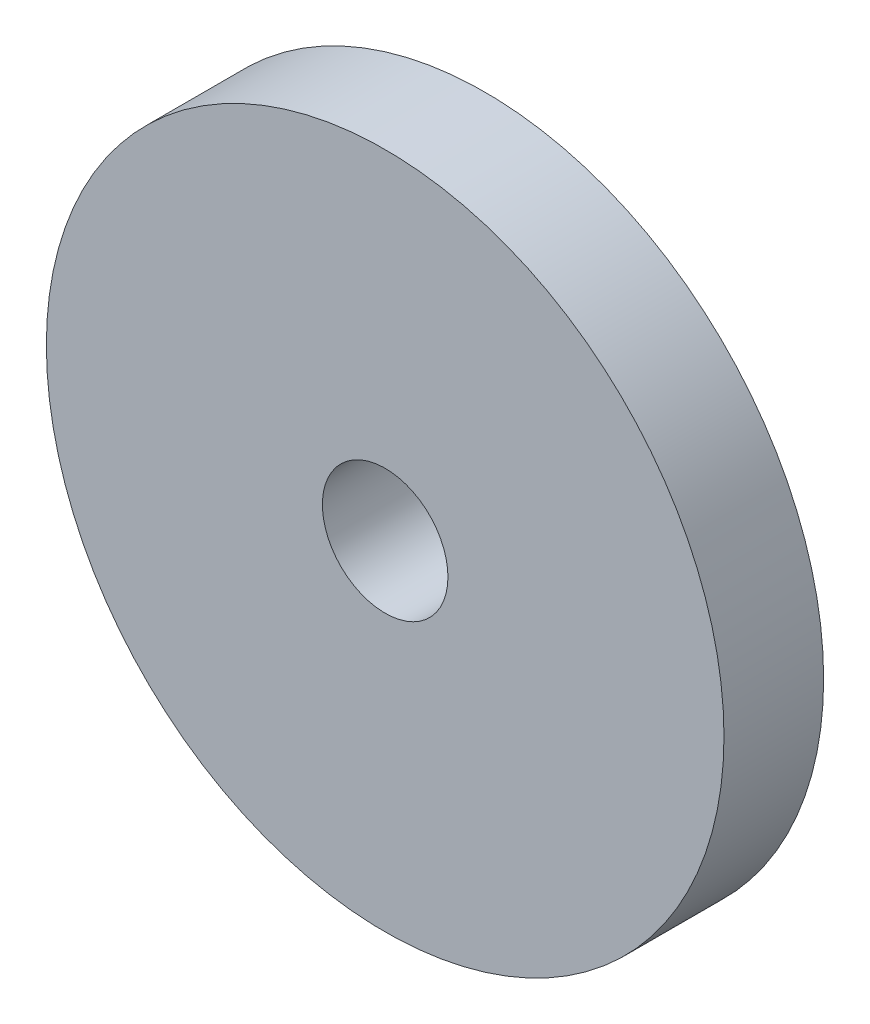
SolidWorks part; units mm, degrees
ref_plane "Plan de face" through (0, 0, 0) normal (0, 0, 1) x (1, 0, 0)
ref_plane "Plan de dessus" through (0, 0, 0) normal (0, 1, 0) x (1, 0, 0)
ref_plane "Plan de droite" through (0, 0, 0) normal (1, 0, 0) x (0, 0, -1)
sketch "Esquisse1" plane through (0, 0, 0) normal (0, 0, 1) x (1, 0, 0)
  circle A0 centre (0, 0) radius 17
  circle A1 centre (0, 0) radius 3.15
extrude "Extrusion1" add sketch "Esquisse1" along normal blind 5
